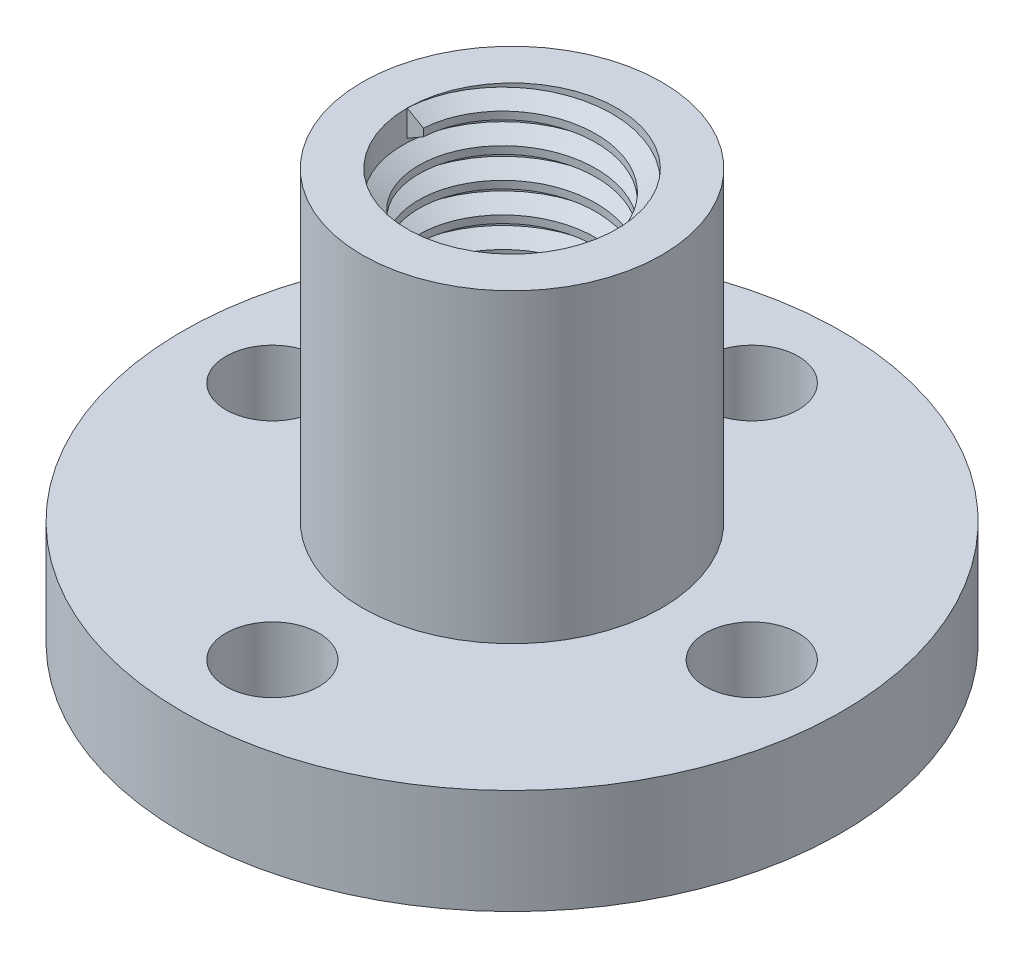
SolidWorks part; units mm, degrees
ref_plane "Спереди" through (0, 0, 0) normal (0, 0, 1) x (1, 0, 0)
ref_plane "Сверху" through (0, 0, 0) normal (0, 1, 0) x (1, 0, 0)
ref_plane "Справа" through (0, 0, 0) normal (1, 0, 0) x (0, 0, -1)
sketch "Эскиз1" plane through (0, 0, 0) normal (0, 0, 1) x (1, 0, 0)
  line L0 (0, 18.9742) -> (0, 0) construction
  line L1 (0, 0) -> (19.7071, 0) construction
  line L2 (3.5, 0) -> (3.5, 15.5)
  line L3 (3.5, 15.5) -> (5, 15.5)
  line L4 (5, 15.5) -> (5, 5.3)
  line L5 (5, 5.3) -> (11, 5.3)
  line L6 (11, 5.3) -> (11, 1.8)
  line L7 (11, 1.8) -> (5, 1.8)
  line L8 (5, 1.8) -> (5, 0)
  line L9 (5, 0) -> (3.5, 0)
  dimension "D1" = 10
  dimension "D2" = 22
  dimension "D3" = 3.5
  dimension "D4" = 15.5
  dimension "D5" = 1.8
  dimension "D6" = 7
revolve "Повернуть1" add sketch "Эскиз1" angle 360 about L0
thread "Резьба1" pitch 1 start angle 0, offset 0, length 15, pitch 1, diameter 7
ref_plane "Плоскость1" through (-3.5, 15.5, 0) normal (0, 0, 1) x (-1, 0, 0)
sketch "Профиль резьбы1" plane through (-3.5, 15.5, 0) normal (0, 0, 1) x (-1, 0, 0)
  line L0 (0, 0) -> (0, 1) construction
  line L11 (0, 0) -> (0, 0.875)
  line L12 (0, 0.875) -> (-0.5413, 0.5625)
  line L13 (-0.5413, 0.5625) -> (-0.5413, 0.3125)
  line L15 (-0.5413, 0.3125) -> (0, 0)
  line L17 (-0.5413, 0.4375) -> (0, 0.4375) construction
  point P2 (0, 0)
  dimension "Pitch" = 1
  dimension "Profile_Angle" = 60
  dimension "Profile_Land" = 0.25
  dimension "Profile_Height" = 0.5413
sketch "Эскиз4" plane through (0, 5.3, 0) normal (0, 1, 0) x (1, 0, 0)
  line L0 (0, 11.7829) -> (0, 0) construction
  line L1 (0, 0) -> (14.7287, 0) construction
  circle A0 centre (0, 8) radius 1.55
  circle A1 centre (0, 0) radius 8 construction
  circle A2 centre (8, 0) radius 1.55
  circle A3 centre (0, -8) radius 1.55
  circle A4 centre (-8, 0) radius 1.55
  point P16 (0, 0)
  dimension "D1" = 16
  dimension "D2" = 3.1
  dimension "D3" = 4
extrude "Вырез-Вытянуть1" cut sketch "Эскиз4" against normal through all
